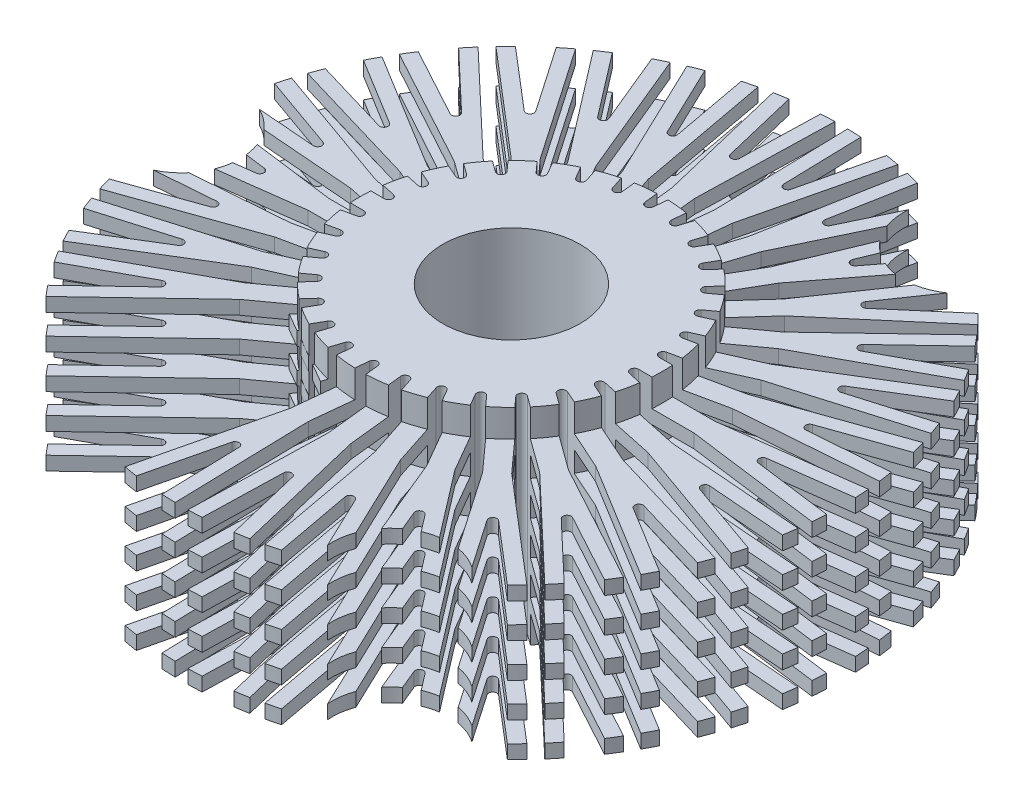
SolidWorks part; units mm, degrees
ref_plane "Plan de face" through (0, 0, 0) normal (0, 0, 1) x (1, 0, 0)
ref_plane "Plan de dessus" through (0, 0, 0) normal (0, 1, 0) x (1, 0, 0)
ref_plane "Plan de droite" through (0, 0, 0) normal (1, 0, 0) x (0, 0, -1)
sketch "Esquisse3" plane through (0, 0, 0) normal (0, 0, 1) x (1, 0, 0)
  line L0 (0, 0) -> (0, 19.454) construction
  line L1 (5, 0) -> (5, 15)
  line L2 (5, 15) -> (11, 15)
  line L3 (11, 15) -> (11, 13)
  line L4 (11, 13) -> (24, 13)
  line L5 (24, 13) -> (24, 12)
  line L6 (24, 12) -> (11, 12)
  line L7 (11, 12) -> (11, 10.5)
  line L8 (11, 10.5) -> (24, 10.5)
  line L9 (24, 10.5) -> (24, 9.5)
  line L10 (24, 9.5) -> (11, 9.5)
  line L11 (11, 9.5) -> (11, 8)
  line L12 (11, 8) -> (24, 8)
  line L13 (24, 8) -> (24, 7)
  line L14 (24, 7) -> (11, 7)
  line L15 (11, 7) -> (11, 5.5)
  line L16 (11, 5.5) -> (24, 5.5)
  line L17 (24, 5.5) -> (24, 4.5)
  line L18 (24, 4.5) -> (11, 4.5)
  line L19 (11, 4.5) -> (11, 3)
  line L20 (11, 3) -> (24, 3)
  line L21 (24, 3) -> (24, 2)
  line L22 (24, 2) -> (11, 2)
  line L23 (11, 2) -> (11, 0)
  line L24 (11, 0) -> (5, 0)
  dimension "D1" = 1
  dimension "D2" = 1.5
  dimension "D3" = 10
  dimension "D4" = 22
  dimension "D5" = 48
  dimension "D6" = 2
  dimension "D7" = 2
revolve "Révolution1" add sketch "Esquisse3" angle 360 about L0
sketch "Esquisse1" plane through (0, 0, 0) normal (0, 1, 0) x (1, 0, 0)
  line L0 (0, 0) -> (36.8598, 0) construction
  line L1 (9.9901, -0.75) -> (14.0355, -0.75)
  line L2 (14.0355, -0.75) -> (23.9123, -2.0503)
  line L3 (23.977, -1.0502) -> (18.2592, -0.2974)
  line L4 (9.9901, 0.75) -> (14.0355, 0.75)
  line L5 (14.0355, 0.75) -> (23.9123, 2.0503)
  line L6 (23.977, 1.0502) -> (18.2592, 0.2974)
  line L7 (0, 0) -> (33.8557, 7.1962) construction
  line L8 (9.9277, 1.3434) -> (12.5133, 1.893) construction
  line L9 (9.9901, 0.75) -> (9.9901, -0.75) construction
  line L10 (9.6158, -2.8107) -> (13.5729, -3.6518)
  line L11 (13.5729, -3.6518) -> (22.9634, -6.9771)
  line L12 (23.2347, -6.0123) -> (17.7984, -4.0872)
  line L13 (9.9277, -1.3434) -> (13.8847, -2.1845)
  line L14 (13.8847, -2.1845) -> (23.816, -2.9661)
  line L15 (23.6714, -3.9579) -> (17.9221, -3.5054)
  line L16 (8.8213, -4.7485) -> (12.517, -6.3939)
  line L17 (12.517, -6.3939) -> (21.011, -11.599)
  line L18 (21.4769, -10.7117) -> (16.5597, -7.6984)
  line L19 (9.4314, -3.3782) -> (13.1271, -5.0236)
  line L20 (13.1271, -5.0236) -> (22.6789, -7.853)
  line L21 (22.3312, -8.7929) -> (16.8016, -7.155)
  line L22 (7.6413, -6.4788) -> (10.9141, -8.8566)
  line L23 (10.9141, -8.8566) -> (18.1403, -15.714)
  line L24 (18.7805, -14.943) -> (14.5972, -10.9731)
  line L25 (8.523, -5.2653) -> (11.7958, -7.6431)
  line L26 (11.7958, -7.6431) -> (20.5506, -12.3965)
  line L27 (20.0151, -13.2437) -> (14.9469, -10.4919)
  line L28 (6.1273, -7.9259) -> (8.8342, -10.9323)
  line L29 (8.8342, -10.9323) -> (12.7278, -16.5974)
  line L30 (14.4158, -17.288) -> (11.9968, -13.7683)
  line L31 (7.242, -6.9222) -> (9.949, -9.9286)
  line L32 (9.949, -9.9286) -> (17.5241, -16.3984)
  line L33 (16.8242, -17.1157) -> (12.4388, -13.3702)
  line L34 (4.3455, -9.0267) -> (6.3682, -12.5301)
  line L35 (6.3682, -12.5301) -> (8.6855, -18.1244)
  line L36 (9.4587, -17.3781) -> (8.872, -15.9617)
  line L37 (5.6446, -8.2767) -> (7.6673, -11.7801)
  line L38 (7.6673, -11.7801) -> (11.3535, -16.5841)
  line L39 (10.3205, -16.8805) -> (9.3872, -15.6642)
  line L40 (2.3738, -9.7329) -> (3.6239, -13.5803)
  line L41 (3.6239, -13.5803) -> (5.4393, -23.3755)
  line L42 (6.4105, -23.128) -> (5.3595, -17.4575)
  line L43 (3.8004, -9.2694) -> (5.0505, -13.1168)
  line L44 (5.0505, -13.1168) -> (8.0099, -19.3213)
  line L45 (7.7639, -21.1284) -> (5.9253, -17.2736)
  line L46 (0.2984, -10.0138) -> (0.7212, -14.037)
  line L47 (0.7212, -14.037) -> (0.4604, -23.9956)
  line L48 (1.4618, -23.9554) -> (1.6128, -18.1903)
  line L49 (1.7901, -9.857) -> (2.213, -13.8802)
  line L50 (2.213, -13.8802) -> (4.5386, -23.567)
  line L51 (3.5507, -23.7359) -> (2.2044, -18.1281)
  line L52 (-1.7901, -9.857) -> (-2.213, -13.8802)
  line L53 (-2.213, -13.8802) -> (-4.5386, -23.567)
  line L54 (-3.5507, -23.7359) -> (-2.2044, -18.1281)
  line L55 (-0.2984, -10.0138) -> (-0.7212, -14.037)
  line L56 (-0.7212, -14.037) -> (-0.4604, -23.9956)
  line L57 (-1.4618, -23.9554) -> (-1.6128, -18.1903)
  line L58 (-3.8004, -9.2694) -> (-4.1392, -10.312)
  line L61 (-2.3738, -9.7329) -> (-2.8111, -11.0787)
  line L64 (-5.6446, -8.2767) -> (-6.1495, -9.1513)
  line L67 (-4.3455, -9.0267) -> (-4.8505, -9.9013)
  line L70 (-7.242, -6.9222) -> (-8.1889, -7.9738)
  line L73 (-6.1273, -7.9259) -> (-6.8608, -8.7406)
  line L74 (-6.8608, -8.7406) -> (-8.1889, -7.9738)
  line L76 (-8.523, -5.2653) -> (-11.7958, -7.6431)
  line L77 (-11.7958, -7.6431) -> (-20.5506, -12.3965)
  line L78 (-20.0151, -13.2437) -> (-14.9469, -10.4919)
  line L79 (-7.6413, -6.4788) -> (-10.9141, -8.8566)
  line L80 (-10.9141, -8.8566) -> (-18.1403, -15.714)
  line L81 (-18.7805, -14.943) -> (-14.5972, -10.9731)
  line L82 (-9.4314, -3.3782) -> (-13.1271, -5.0236)
  line L83 (-13.1271, -5.0236) -> (-22.6789, -7.853)
  line L84 (-22.3312, -8.7929) -> (-16.8016, -7.155)
  line L85 (-8.8213, -4.7485) -> (-12.517, -6.3939)
  line L86 (-12.517, -6.3939) -> (-21.011, -11.599)
  line L87 (-21.4769, -10.7117) -> (-16.5597, -7.6984)
  line L88 (-9.9277, -1.3434) -> (-13.8847, -2.1845)
  line L89 (-13.8847, -2.1845) -> (-20.7376, -2.7239)
  line L90 (-22.1797, -3.8405) -> (-17.9221, -3.5054)
  line L91 (-9.6158, -2.8107) -> (-13.5729, -3.6518)
  line L92 (-13.5729, -3.6518) -> (-22.9634, -6.9771)
  line L93 (-23.2347, -6.0123) -> (-17.7984, -4.0872)
  line L94 (-9.9901, 0.75) -> (-14.0355, 0.75)
  line L95 (-14.0355, 0.75) -> (-20.039, 1.5404)
  line L96 (-19.7792, 0.4975) -> (-18.2592, 0.2974)
  line L97 (-9.9901, -0.75) -> (-14.0355, -0.75)
  line L98 (-14.0355, -0.75) -> (-20.039, -1.5404)
  line L99 (-19.7792, -0.4975) -> (-18.2592, -0.2974)
  line L100 (-9.6158, 2.8107) -> (-13.5729, 3.6518)
  line L101 (-13.5729, 3.6518) -> (-22.9634, 6.9771)
  line L102 (-23.2347, 6.0123) -> (-17.7984, 4.0872)
  line L103 (-9.9277, 1.3434) -> (-13.8847, 2.1845)
  line L104 (-13.8847, 2.1845) -> (-20.7376, 2.7239)
  line L105 (-22.1797, 3.8405) -> (-17.9221, 3.5054)
  line L106 (-8.8213, 4.7485) -> (-12.517, 6.3939)
  line L107 (-12.517, 6.3939) -> (-21.011, 11.599)
  line L108 (-21.4769, 10.7117) -> (-16.5597, 7.6984)
  line L109 (-9.4314, 3.3782) -> (-13.1271, 5.0236)
  line L110 (-13.1271, 5.0236) -> (-22.6789, 7.853)
  line L111 (-22.3312, 8.7929) -> (-16.8016, 7.155)
  line L112 (-7.6413, 6.4788) -> (-10.9141, 8.8566)
  line L113 (-10.9141, 8.8566) -> (-18.1403, 15.714)
  line L114 (-18.7805, 14.943) -> (-14.5972, 10.9731)
  line L115 (-8.523, 5.2653) -> (-11.7958, 7.6431)
  line L116 (-11.7958, 7.6431) -> (-20.5506, 12.3965)
  line L117 (-20.0151, 13.2437) -> (-14.9469, 10.4919)
  line L118 (-6.1273, 7.9259) -> (-8.8342, 10.9323)
  line L119 (-8.8342, 10.9323) -> (-14.4768, 19.1422)
  line L120 (-15.2633, 18.5211) -> (-11.9968, 13.7683)
  line L121 (-7.242, 6.9222) -> (-9.949, 9.9286)
  line L122 (-9.949, 9.9286) -> (-17.5241, 16.3984)
  line L123 (-16.8242, 17.1157) -> (-12.4388, 13.3702)
  line L124 (-4.3455, 9.0267) -> (-6.3682, 12.5301)
  line L125 (-6.3682, 12.5301) -> (-10.1805, 21.7338)
  line L126 (-11.079, 21.2898) -> (-8.872, 15.9617)
  line L127 (-5.6446, 8.2767) -> (-7.6673, 11.7801)
  line L128 (-7.6673, 11.7801) -> (-13.7317, 19.6835)
  line L129 (-12.898, 20.2396) -> (-9.3872, 15.6642)
  line L130 (-2.3738, 9.7329) -> (-3.6239, 13.5803)
  line L131 (-3.6239, 13.5803) -> (-5.4393, 23.3755)
  line L132 (-6.4105, 23.128) -> (-5.3595, 17.4575)
  line L133 (-3.8004, 9.2694) -> (-5.0505, 13.1168)
  line L134 (-5.0505, 13.1168) -> (-9.3392, 22.1083)
  line L135 (-8.4081, 22.479) -> (-5.9253, 17.2736)
  line L136 (-0.2984, 10.0138) -> (-0.7212, 14.037)
  line L137 (-0.7212, 14.037) -> (-0.4604, 23.9956)
  line L138 (-1.4618, 23.9554) -> (-1.6128, 18.1903)
  line L139 (-1.7901, 9.857) -> (-2.213, 13.8802)
  line L140 (-2.213, 13.8802) -> (-4.5386, 23.567)
  line L141 (-3.5507, 23.7359) -> (-2.2044, 18.1281)
  line L142 (1.7901, 9.857) -> (2.213, 13.8802)
  line L143 (2.213, 13.8802) -> (4.5386, 23.567)
  line L144 (3.5507, 23.7359) -> (2.2044, 18.1281)
  line L145 (0.2984, 10.0138) -> (0.7212, 14.037)
  line L146 (0.7212, 14.037) -> (0.4604, 23.9956)
  line L147 (1.4618, 23.9554) -> (1.6128, 18.1903)
  line L148 (3.8004, 9.2694) -> (5.0505, 13.1168)
  line L149 (5.0505, 13.1168) -> (8.0099, 19.3213)
  line L150 (7.7639, 21.1284) -> (5.9253, 17.2736)
  line L151 (2.3738, 9.7329) -> (3.6239, 13.5803)
  line L152 (3.6239, 13.5803) -> (5.4393, 23.3755)
  line L153 (6.4105, 23.128) -> (5.3595, 17.4575)
  line L154 (5.6446, 8.2767) -> (7.6673, 11.7801)
  line L155 (7.6673, 11.7801) -> (11.3535, 16.5841)
  line L156 (10.3205, 16.8805) -> (9.3872, 15.6642)
  line L157 (4.3455, 9.0267) -> (6.3682, 12.5301)
  line L158 (6.3682, 12.5301) -> (8.6855, 18.1244)
  line L159 (9.4587, 17.3781) -> (8.872, 15.9617)
  line L160 (7.242, 6.9222) -> (9.949, 9.9286)
  line L161 (9.949, 9.9286) -> (17.5241, 16.3984)
  line L162 (16.8242, 17.1157) -> (12.4388, 13.3702)
  line L163 (6.1273, 7.9259) -> (8.8342, 10.9323)
  line L164 (8.8342, 10.9323) -> (12.7278, 16.5974)
  line L165 (14.4158, 17.288) -> (11.9968, 13.7683)
  line L166 (8.523, 5.2653) -> (11.7958, 7.6431)
  line L167 (11.7958, 7.6431) -> (20.5506, 12.3965)
  line L168 (20.0151, 13.2437) -> (14.9469, 10.4919)
  line L169 (7.6413, 6.4788) -> (10.9141, 8.8566)
  line L170 (10.9141, 8.8566) -> (18.1403, 15.714)
  line L171 (18.7805, 14.943) -> (14.5972, 10.9731)
  line L172 (9.4314, 3.3782) -> (13.1271, 5.0236)
  line L173 (13.1271, 5.0236) -> (22.6789, 7.853)
  line L174 (22.3312, 8.7929) -> (16.8016, 7.155)
  line L175 (8.8213, 4.7485) -> (12.517, 6.3939)
  line L176 (12.517, 6.3939) -> (21.011, 11.599)
  line L177 (21.4769, 10.7117) -> (16.5597, 7.6984)
  line L178 (9.9277, 1.3434) -> (13.8847, 2.1845)
  line L179 (13.8847, 2.1845) -> (23.816, 2.9661)
  line L180 (23.6714, 3.9579) -> (17.9221, 3.5054)
  line L181 (9.6158, 2.8107) -> (13.5729, 3.6518)
  line L182 (13.5729, 3.6518) -> (22.9634, 6.9771)
  line L183 (23.2347, 6.0123) -> (17.7984, 4.0872)
  line L193 (-24, 4.25) -> (-36.3367, 4.25)
  line L194 (-24, -4.25) -> (-36.3367, -4.25)
  line L195 (-36.3367, -4.25) -> (-36.3367, 4.25)
  line L196 (15.6806, 18.6596) -> (21.849, 29.3435)
  line L197 (8.3194, 22.9096) -> (14.4877, 33.5935)
  line L198 (14.4877, 33.5935) -> (21.849, 29.3435)
  line L199 (8.3194, -22.9096) -> (14.4877, -33.5935)
  line L200 (15.6806, -18.6596) -> (21.849, -29.3435)
  line L201 (21.849, -29.3435) -> (14.4877, -33.5935)
  line L204 (0, 0) -> (-18.3414, -31.7682) construction
  line L207 (0, 0) -> (-47.6717, 0) construction
  line L210 (-4.8505, -9.9013) -> (-6.1495, -9.1513)
  line L211 (-2.8111, -11.0787) -> (-4.1392, -10.312)
  line L212 (-8.8342, -10.9323) -> (-14.4768, -19.1422)
  line L213 (-6.3682, -12.5301) -> (-10.1805, -21.7338)
  line L214 (-5.0505, -13.1168) -> (-9.3392, -22.1083)
  line L215 (-8.4081, -22.479) -> (-5.9253, -17.2736)
  line L216 (-11.079, -21.2898) -> (-8.872, -15.9617)
  line L217 (-12.898, -20.2396) -> (-9.3872, -15.6642)
  line L218 (-7.6673, -11.7801) -> (-13.7317, -19.6835)
  line L219 (-15.2633, -18.5211) -> (-11.9968, -13.7683)
  line L220 (-16.8242, -17.1157) -> (-14.4842, -15.1172)
  line L221 (-12.9864, -12.5228) -> (-17.5241, -16.3984)
  line L222 (-4.3519, -17.5079) -> (-5.4393, -23.3755)
  line L223 (-6.4105, -23.128) -> (-5.8497, -20.1023)
  arc A0 (23.9123, -2.0503) -> (23.977, -1.0502) centre (0, 0) ccw
  circle A1 centre (0, 0) radius 30
  arc A2 (18.2592, -0.2974) -> (18.2592, 0.2974) centre (18.2984, 0) cw
  arc A3 (9.9277, 1.3434) -> (9.9901, 0.75) centre (9.9901, 1.05) ccw
  arc A4 (23.977, 1.0502) -> (23.9123, 2.0503) centre (0, 0) ccw
  arc A5 (22.9634, -6.9771) -> (23.2347, -6.0123) centre (0, 0) ccw
  arc A6 (17.7984, -4.0872) -> (17.9221, -3.5054) centre (17.8985, -3.8044) cw
  arc A7 (9.9901, -0.75) -> (9.9277, -1.3434) centre (9.9901, -1.05) ccw
  arc A8 (23.6714, -3.9579) -> (23.816, -2.9661) centre (0, 0) ccw
  arc A9 (21.011, -11.599) -> (21.4769, -10.7117) centre (0, 0) ccw
  arc A10 (16.5597, -7.6984) -> (16.8016, -7.155) centre (16.7164, -7.4426) cw
  arc A11 (9.6158, -2.8107) -> (9.4314, -3.3782) centre (9.5535, -3.1041) ccw
  arc A12 (22.3312, -8.7929) -> (22.6789, -7.853) centre (0, 0) ccw
  arc A13 (18.1403, -15.714) -> (18.7805, -14.943) centre (0, 0) ccw
  arc A14 (14.5972, -10.9731) -> (14.9469, -10.4919) centre (14.8037, -10.7555) cw
  arc A15 (8.8213, -4.7485) -> (8.523, -5.2653) centre (8.6993, -5.0226) ccw
  arc A16 (20.0151, -13.2437) -> (20.5506, -12.3965) centre (0, 0) ccw
  arc A18 (11.9968, -13.7683) -> (12.4388, -13.3702) centre (12.244, -13.5984) cw
  arc A19 (7.6413, -6.4788) -> (7.242, -6.9222) centre (7.465, -6.7215) ccw
  arc A20 (16.8242, -17.1157) -> (17.5241, -16.3984) centre (0, 0) ccw
  arc A21 (11.3535, -16.5841) -> (10.3205, -16.8805) centre (12, -20.7846) ccw
  arc A22 (8.872, -15.9617) -> (9.3872, -15.6642) centre (9.1492, -15.8469) cw
  arc A23 (6.1273, -7.9259) -> (5.6446, -8.2767) centre (5.9044, -8.1267) ccw
  arc A24 (9.4587, -17.3781) -> (8.6855, -18.1244) centre (12, -20.7846) ccw
  arc A25 (5.4393, -23.3755) -> (6.4105, -23.128) centre (0, 0) ccw
  arc A26 (5.3595, -17.4575) -> (5.9253, -17.2736) centre (5.6545, -17.4028) cw
  arc A27 (4.3455, -9.0267) -> (3.8004, -9.2694) centre (4.0857, -9.1767) ccw
  arc A29 (0.4604, -23.9956) -> (1.4618, -23.9554) centre (0, 0) ccw
  arc A30 (1.6128, -18.1903) -> (2.2044, -18.1281) centre (1.9127, -18.1981) cw
  arc A31 (2.3738, -9.7329) -> (1.7901, -9.857) centre (2.0885, -9.8256) ccw
  arc A32 (3.5507, -23.7359) -> (4.5386, -23.567) centre (0, 0) ccw
  arc A33 (-4.5386, -23.567) -> (-3.5507, -23.7359) centre (0, 0) ccw
  arc A34 (-2.2044, -18.1281) -> (-1.6128, -18.1903) centre (-1.9127, -18.1981) cw
  arc A35 (0.2984, -10.0138) -> (-0.2984, -10.0138) centre (0, -10.0451) ccw
  arc A36 (-1.4618, -23.9554) -> (-0.4604, -23.9956) centre (0, 0) ccw
  arc A39 (-1.7901, -9.857) -> (-2.3738, -9.7329) centre (-2.0885, -9.8256) ccw
  arc A43 (-3.8004, -9.2694) -> (-4.3455, -9.0267) centre (-4.0857, -9.1767) ccw
  arc A47 (-5.6446, -8.2767) -> (-6.1273, -7.9259) centre (-5.9044, -8.1267) ccw
  arc A49 (-20.5506, -12.3965) -> (-20.0151, -13.2437) centre (0, 0) ccw
  arc A50 (-14.9469, -10.4919) -> (-14.5972, -10.9731) centre (-14.8037, -10.7555) cw
  arc A51 (-7.242, -6.9222) -> (-7.6413, -6.4788) centre (-7.465, -6.7215) ccw
  arc A52 (-18.7805, -14.943) -> (-18.1403, -15.714) centre (0, 0) ccw
  arc A53 (-22.6789, -7.853) -> (-22.3312, -8.7929) centre (0, 0) ccw
  arc A54 (-16.8016, -7.155) -> (-16.5597, -7.6984) centre (-16.7164, -7.4426) cw
  arc A55 (-8.523, -5.2653) -> (-8.8213, -4.7485) centre (-8.6993, -5.0226) ccw
  arc A56 (-21.4769, -10.7117) -> (-21.011, -11.599) centre (0, 0) ccw
  arc A57 (-20.039, -1.5404) -> (-19.7792, -0.4975) centre (-24, 0) ccw
  arc A58 (-17.9221, -3.5054) -> (-17.7984, -4.0872) centre (-17.8985, -3.8044) cw
  arc A59 (-9.4314, -3.3782) -> (-9.6158, -2.8107) centre (-9.5535, -3.1041) ccw
  arc A60 (-23.2347, -6.0123) -> (-22.9634, -6.9771) centre (0, 0) ccw
  arc A61 (-20.7376, 2.7239) -> (-22.1797, 3.8405) centre (-24, 0) ccw
  arc A62 (-18.2592, 0.2974) -> (-18.2592, -0.2974) centre (-18.2984, 0) cw
  arc A63 (-9.9277, -1.3434) -> (-9.9901, -0.75) centre (-9.9901, -1.05) ccw
  arc A64 (12.7278, 16.5974) -> (14.4158, 17.288) centre (12, 20.7846) ccw
  arc A65 (-22.9634, 6.9771) -> (-23.2347, 6.0123) centre (0, 0) ccw
  arc A66 (-17.7984, 4.0872) -> (-17.9221, 3.5054) centre (-17.8985, 3.8044) cw
  arc A67 (-9.9901, 0.75) -> (-9.9277, 1.3434) centre (-9.9901, 1.05) ccw
  arc A68 (-19.7792, 0.4975) -> (-20.039, 1.5404) centre (-24, 0) ccw
  arc A69 (-21.011, 11.599) -> (-21.4769, 10.7117) centre (0, 0) ccw
  arc A70 (-16.5597, 7.6984) -> (-16.8016, 7.155) centre (-16.7164, 7.4426) cw
  arc A71 (-9.6158, 2.8107) -> (-9.4314, 3.3782) centre (-9.5535, 3.1041) ccw
  arc A72 (-22.3312, 8.7929) -> (-22.6789, 7.853) centre (0, 0) ccw
  arc A73 (-18.1403, 15.714) -> (-18.7805, 14.943) centre (0, 0) ccw
  arc A74 (-14.5972, 10.9731) -> (-14.9469, 10.4919) centre (-14.8037, 10.7555) cw
  arc A75 (-8.8213, 4.7485) -> (-8.523, 5.2653) centre (-8.6993, 5.0226) ccw
  arc A76 (-20.0151, 13.2437) -> (-20.5506, 12.3965) centre (0, 0) ccw
  arc A77 (-14.4768, 19.1422) -> (-15.2633, 18.5211) centre (0, 0) ccw
  arc A78 (-11.9968, 13.7683) -> (-12.4388, 13.3702) centre (-12.244, 13.5984) cw
  arc A79 (-7.6413, 6.4788) -> (-7.242, 6.9222) centre (-7.465, 6.7215) ccw
  arc A80 (-16.8242, 17.1157) -> (-17.5241, 16.3984) centre (0, 0) ccw
  arc A81 (-10.1805, 21.7338) -> (-11.079, 21.2898) centre (0, 0) ccw
  arc A82 (-8.872, 15.9617) -> (-9.3872, 15.6642) centre (-9.1492, 15.8469) cw
  arc A83 (-6.1273, 7.9259) -> (-5.6446, 8.2767) centre (-5.9044, 8.1267) ccw
  arc A84 (-12.898, 20.2396) -> (-13.7317, 19.6835) centre (0, 0) ccw
  arc A85 (-5.4393, 23.3755) -> (-6.4105, 23.128) centre (0, 0) ccw
  arc A86 (-5.3595, 17.4575) -> (-5.9253, 17.2736) centre (-5.6545, 17.4028) cw
  arc A87 (-4.3455, 9.0267) -> (-3.8004, 9.2694) centre (-4.0857, 9.1767) ccw
  arc A88 (-8.4081, 22.479) -> (-9.3392, 22.1083) centre (0, 0) ccw
  arc A89 (-0.4604, 23.9956) -> (-1.4618, 23.9554) centre (0, 0) ccw
  arc A90 (-1.6128, 18.1903) -> (-2.2044, 18.1281) centre (-1.9127, 18.1981) cw
  arc A91 (-2.3738, 9.7329) -> (-1.7901, 9.857) centre (-2.0885, 9.8256) ccw
  arc A92 (-3.5507, 23.7359) -> (-4.5386, 23.567) centre (0, 0) ccw
  arc A93 (4.5386, 23.567) -> (3.5507, 23.7359) centre (0, 0) ccw
  arc A94 (2.2044, 18.1281) -> (1.6128, 18.1903) centre (1.9127, 18.1981) cw
  arc A95 (-0.2984, 10.0138) -> (0.2984, 10.0138) centre (0, 10.0451) ccw
  arc A96 (1.4618, 23.9554) -> (0.4604, 23.9956) centre (0, 0) ccw
  arc A97 (10.3205, 16.8805) -> (11.3535, 16.5841) centre (12, 20.7846) ccw
  arc A98 (5.9253, 17.2736) -> (5.3595, 17.4575) centre (5.6545, 17.4028) cw
  arc A99 (1.7901, 9.857) -> (2.3738, 9.7329) centre (2.0885, 9.8256) ccw
  arc A100 (6.4105, 23.128) -> (5.4393, 23.3755) centre (0, 0) ccw
  arc A101 (8.6855, 18.1244) -> (9.4587, 17.3781) centre (12, 20.7846) ccw
  arc A102 (9.3872, 15.6642) -> (8.872, 15.9617) centre (9.1492, 15.8469) cw
  arc A103 (3.8004, 9.2694) -> (4.3455, 9.0267) centre (4.0857, 9.1767) ccw
  arc A104 (8.0099, -19.3213) -> (7.7639, -21.1284) centre (12, -20.7846) ccw
  arc A105 (17.5241, 16.3984) -> (16.8242, 17.1157) centre (0, 0) ccw
  arc A106 (12.4388, 13.3702) -> (11.9968, 13.7683) centre (12.244, 13.5984) cw
  arc A107 (5.6446, 8.2767) -> (6.1273, 7.9259) centre (5.9044, 8.1267) ccw
  arc A109 (20.5506, 12.3965) -> (20.0151, 13.2437) centre (0, 0) ccw
  arc A110 (14.9469, 10.4919) -> (14.5972, 10.9731) centre (14.8037, 10.7555) cw
  arc A111 (7.242, 6.9222) -> (7.6413, 6.4788) centre (7.465, 6.7215) ccw
  arc A112 (18.7805, 14.943) -> (18.1403, 15.714) centre (0, 0) ccw
  arc A113 (22.6789, 7.853) -> (22.3312, 8.7929) centre (0, 0) ccw
  arc A114 (16.8016, 7.155) -> (16.5597, 7.6984) centre (16.7164, 7.4426) cw
  arc A115 (8.523, 5.2653) -> (8.8213, 4.7485) centre (8.6993, 5.0226) ccw
  arc A116 (21.4769, 10.7117) -> (21.011, 11.599) centre (0, 0) ccw
  arc A117 (23.816, 2.9661) -> (23.6714, 3.9579) centre (0, 0) ccw
  arc A118 (17.9221, 3.5054) -> (17.7984, 4.0872) centre (17.8985, 3.8044) cw
  arc A119 (9.4314, 3.3782) -> (9.6158, 2.8107) centre (9.5535, 3.1041) ccw
  arc A120 (23.2347, 6.0123) -> (22.9634, 6.9771) centre (0, 0) ccw
  arc A121 (-22.1797, -3.8405) -> (-20.7376, -2.7239) centre (-24, 0) ccw
  arc A122 (7.7639, 21.1284) -> (8.0099, 19.3213) centre (12, 20.7846) ccw
  arc A123 (14.4158, -17.288) -> (12.7278, -16.5974) centre (12, -20.7846) ccw
  arc A124 (-23.6714, 3.9579) -> (-23.816, 2.9661) centre (0, 0) ccw
  arc A125 (-23.9123, 2.0503) -> (-23.977, 1.0502) centre (0, 0) ccw
  arc A126 (-23.977, -1.0502) -> (-23.9123, -2.0503) centre (0, 0) ccw
  arc A127 (-23.816, -2.9661) -> (-23.6714, -3.9579) centre (0, 0) ccw
  arc A128 (9.3392, 22.1083) -> (8.4081, 22.479) centre (0, 0) ccw
  arc A129 (11.079, 21.2898) -> (10.1805, 21.7338) centre (0, 0) ccw
  arc A130 (13.7317, 19.6835) -> (12.898, 20.2396) centre (0, 0) ccw
  arc A131 (15.2633, 18.5211) -> (14.4768, 19.1422) centre (0, 0) ccw
  arc A132 (12.898, -20.2396) -> (13.7317, -19.6835) centre (0, 0) ccw
  arc A133 (8.4081, -22.479) -> (9.3392, -22.1083) centre (0, 0) ccw
  arc A134 (10.1805, -21.7338) -> (11.079, -21.2898) centre (0, 0) ccw
  arc A135 (14.4768, -19.1422) -> (15.2633, -18.5211) centre (0, 0) ccw
  arc A136 (-5.9253, -17.2736) -> (-5.3595, -17.4575) centre (-5.6545, -17.4028) cw
  arc A137 (-9.3392, -22.1083) -> (-8.4081, -22.479) centre (0, 0) ccw
  arc A138 (-11.079, -21.2898) -> (-10.1805, -21.7338) centre (0, 0) ccw
  arc A139 (-12.4388, -13.3702) -> (-11.9968, -13.7683) centre (-12.244, -13.5984) cw
  arc A140 (-9.3872, -15.6642) -> (-8.9992, -15.5871) centre (-9.1492, -15.8469) cw
  arc A141 (-15.2633, -18.5211) -> (-14.4768, -19.1422) centre (0, 0) ccw
  arc A142 (-17.5241, -16.3984) -> (-16.8242, -17.1157) centre (0, 0) ccw
  arc A143 (-6.4105, -23.128) -> (-5.4393, -23.3755) centre (0, 0) ccw
  arc A144 (-13.7317, -19.6835) -> (-12.898, -20.2396) centre (0, 0) ccw
  point P16 (16, 0)
  dimension "D1" = 48
  dimension "D6" = 0.3
  dimension "D9" = 0.3
  dimension "D11" = 60
  dimension "D13" = 4.25
  dimension "D17" = 60
  dimension "D2" = 15
  dimension "D3" = 1.5
  dimension "D4" = 1
  dimension "D5" = 16
  dimension "D7" = 12
  dimension "D8" = 0.75
  dimension "D12" = 24
  dimension "D15" = 24
  dimension "D16" = 24
  dimension "D18" = 11
  dimension "D10" = 30
  dimension "D14" = 3
extrude "Enlèv. mat.-Extru.2" cut sketch "Esquisse1" along normal through all
sketch "Esquisse2" plane through (0, 0, 0) normal (0, 1, 0) x (1, 0, 0)
  circle A0 centre (0, 0) radius 7.4847
